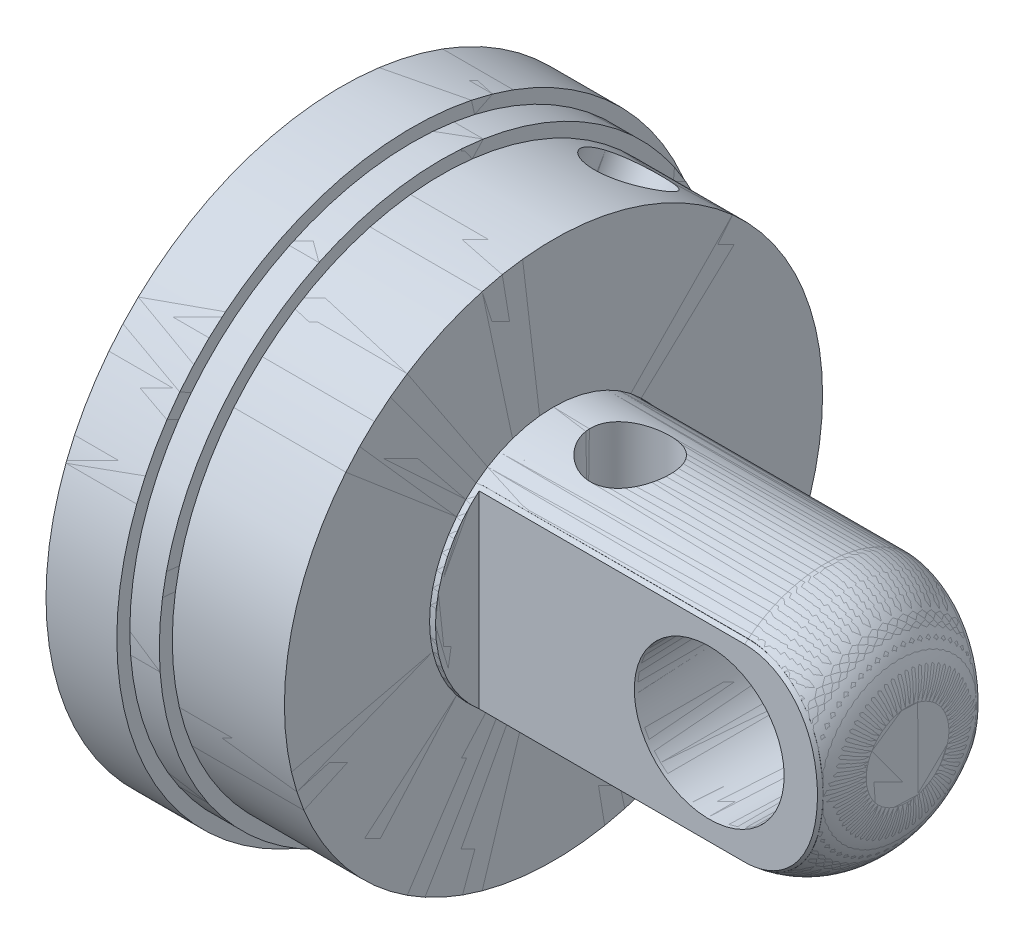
SolidWorks part; units mm, degrees
ref_plane "Face" through (0, 0, 0) normal (0, 0, 1) x (1, 0, 0)
ref_plane "Dessus" through (0, 0, 0) normal (0, 1, 0) x (1, 0, 0)
ref_plane "Droite" through (0, 0, 0) normal (1, 0, 0) x (0, 0, -1)
imported_body "Importée1"
sketch "Esquisse1" plane through (-19.5, 0, 0) normal (1, 0, 0) x (0, 0, -1)
  line L0 (0, 26.4) -> (0, -26.4) construction
  line L1 (-6.5, 10.5) -> (6.5, 10.5)
  line L2 (-6.5, 10.5) -> (-6.5, -10.5)
  line L3 (-6.5, -10.5) -> (6.5, -10.5)
  line L4 (6.5, 10.5) -> (6.5, -10.5)
  arc A0 (-6.805, -7.9964) -> (6.805, -7.9964) centre (0, 0) ccw construction
  arc A1 (6.805, 7.9964) -> (-6.805, 7.9964) centre (0, 0) ccw construction
  point P4 (0, 10.5)
  dimension "D1" = 13
extrude "A_Axial" cut sketch "Esquisse1" along normal through all flip side to cut
